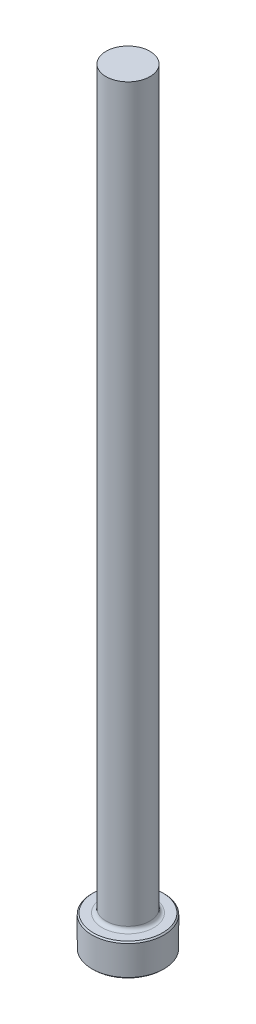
SolidWorks part; units mm, degrees
ref_plane "Front Plane" through (0, 0, 0) normal (0, 0, 1) x (1, 0, 0)
ref_plane "Top Plane" through (0, 0, 0) normal (0, 1, 0) x (1, 0, 0)
ref_plane "Right Plane" through (0, 0, 0) normal (1, 0, 0) x (0, 0, -1)
sketch "Sketch1" plane through (0, 0, 0) normal (0, 0, 1) x (1, 0, 0)
  line L0 (0, 259.9588) -> (0, -15.1925) construction
  line L1 (0, 0) -> (-7.1374, 0)
  line L2 (-7.1374, 0) -> (-7.1374, 6.35)
  line L3 (-7.1374, 6.35) -> (-4.365, 6.35)
  line L4 (-4.365, 6.35) -> (-4.365, 152.4)
  line L5 (-4.365, 152.4) -> (0, 152.4)
  line L6 (0, 152.4) -> (0, 0)
  dimension "L" = 152.4
  dimension "H" = 14.2748
  dimension "T" = 6.35
  dimension "D" = 8.73
revolve "Revolve1" add sketch "Sketch1" angle 360 about L0
chamfer "Chamfer1" distance 0.254 angle 45 2 edges at (0, 6.35, 7.1374) (0, 0, 7.1374)
fillet "Fillet1" radius 0.762 1 edges at (0, 6.35, 4.365)
sketch "Pocket Sketch" plane through (0, 0, 0) normal (0, 0, 1) x (1, 0, 0)
  line L0 (-7.5343, 0) -> (-7.5343, 6.3754)
  line L1 (-7.5343, 6.3754) -> (-5.5239, 6.3754)
  line L2 (-4.7619, 7.1374) -> (-4.7619, 22.225)
  line L3 (-4.7619, 22.225) -> (0, 22.225)
  line L4 (0, 22.225) -> (0, 0)
  line L5 (0, 0) -> (-7.5343, 0)
  line L6 (0, 12.6104) -> (0, -2.4989) construction
  line L7 (-7.1374, 6.096) -> (-7.1374, 0.254) construction
  line L8 (6.8834, 6.35) -> (-6.8834, 6.35) construction
  line L9 (-4.365, 152.4) -> (-4.365, 7.112) construction
  line L10 (-5.5239, 6.3754) -> (-4.7619, 7.1374)
  point P3 (-4.7619, 6.3754)
  dimension "D1" = 15.0685
  dimension "D2" = 0.3969
  dimension "D3" = 0.0254
  dimension "D4" = 0.3969
  dimension "D5" = 9.5237
  dimension "D6" = 22.225
